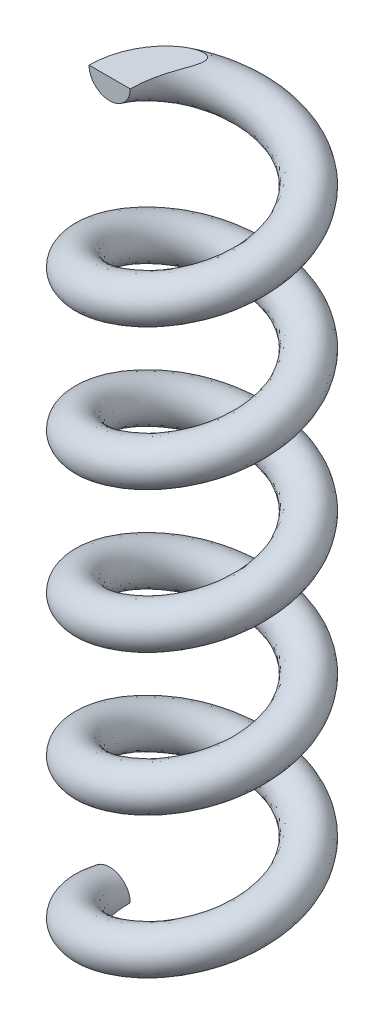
SolidWorks part; units mm, degrees
ref_plane "Front Plane" through (0, 0, 0) normal (0, 0, 1) x (1, 0, 0)
ref_plane "Top Plane" through (0, 0, 0) normal (0, 1, 0) x (1, 0, 0)
ref_plane "Right Plane" through (0, 0, 0) normal (1, 0, 0) x (0, 0, -1)
sketch "Sketch1" plane through (0, 0, 0) normal (0, 0, 1) x (1, 0, 0)
  line L1 (-24, -71.5) -> (-38, -71.5) construction
  circle A0 centre (-38, -71.5) radius 3.5
  dimension "D3" = 7
  dimension "D2" = 14
sketch "Sketch5" plane through (0, 0, 0) normal (0, 0, 1) x (1, 0, 0)
  line L0 (-24, -71.5) -> (-24, 48.3237)
  line L3 (-29, 48.3237) -> (-19, 48.3237) construction
  point P3 (0, 0)
  point P4 (0, 0)
  point P5 (0, 0)
  point P7 (0, 0)
sweep "Sweep3" add profiles "Sketch1" path "Sketch5" parameters "D4"=1800
ref_plane "Plane3" through (0, 48.3237, 0) normal (0, 1, 0) x (1, 0, 0)
ref_plane "Plane4" through (0, -71.5, 0) normal (0, 1, 0) x (1, 0, 0)
other "SurfaceCut1"
other "SurfaceCut2"
